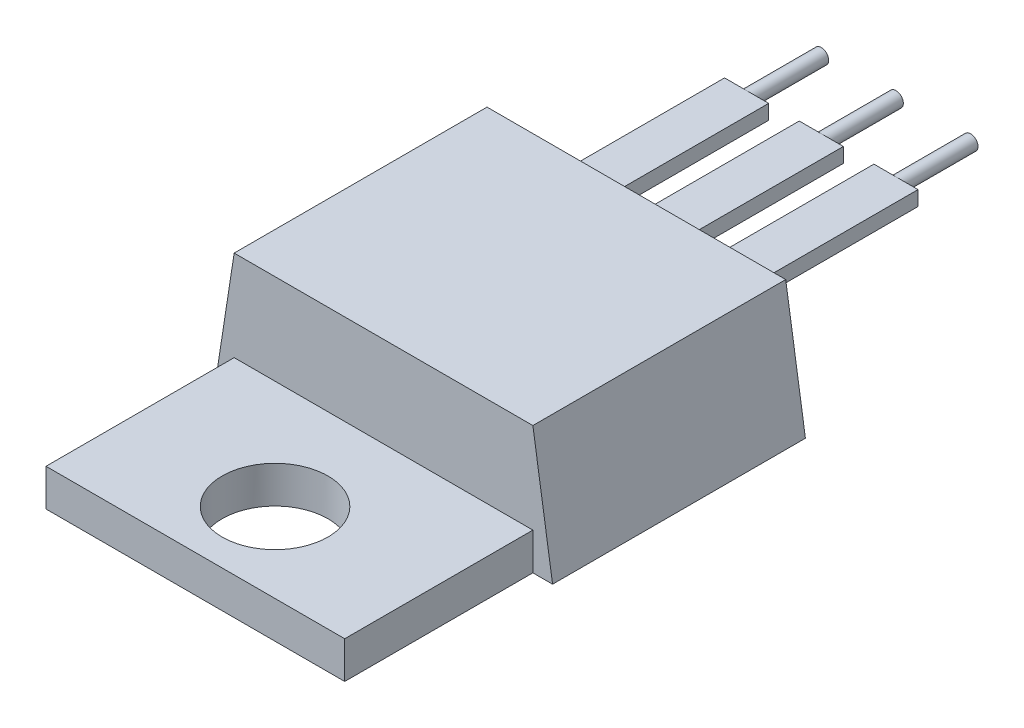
SolidWorks part; units mm, degrees
ref_plane "Спереди" through (0, 0, 0) normal (0, 0, 1) x (1, 0, 0)
ref_plane "Сверху" through (0, 0, 0) normal (0, 1, 0) x (1, 0, 0)
ref_plane "Справа" through (0, 0, 0) normal (1, 0, 0) x (0, 0, -1)
sketch "Эскиз1" plane through (0, 0, 0) normal (0, 0, 1) x (1, 0, 0)
  line L0 (-5.75, -2.7) -> (5.75, -2.7)
  line L1 (-5.08, 1.64) -> (5.08, 1.64)
  line L2 (5.75, -2.7) -> (5.08, 1.64)
  line L3 (-5.75, -2.7) -> (-5.08, 1.64)
extrude "Бобышка-Вытянуть1" add sketch "Эскиз1" along normal blind 8.6
sketch "Эскиз2" plane through (0, 0, 8.6) normal (0, 0, 1) x (1, 0, 0)
  line L0 (-5.75, -2.7) -> (5.75, -2.7) construction
  line L2 (-5.08, -2.7) -> (5.08, -2.7)
  line L3 (-5.08, -2.7) -> (-5.08, -1.44)
  line L4 (-5.08, -1.44) -> (5.08, -1.44)
  line L6 (5.08, -2.7) -> (5.08, -1.44)
extrude "Бобышка-Вытянуть2" add sketch "Эскиз2" along normal blind 6.4 and the other way blind 7.6 separate body
sketch "Эскиз3" plane through (0, -1.44, 0) normal (0, 1, 0) x (1, 0, 0)
  circle A0 centre (0, -12.29) radius 1.8
extrude "Вырез-Вытянуть1" cut sketch "Эскиз3" against normal up to surface (1.26 mm away)
sketch "Эскиз4" plane through (0, 0, 0) normal (0, 0, -1) x (-1, 0, 0)
  line L1 (-0.75, 0.25) -> (0.75, 0.25)
  line L2 (-0.75, 0.25) -> (-0.75, -0.25)
  line L3 (-0.75, -0.25) -> (0.75, -0.25)
  line L4 (0.75, 0.25) -> (0.75, -0.25)
  line L5 (-1.79, 0.25) -> (-3.29, 0.25)
  line L6 (-1.79, 0.25) -> (-1.79, -0.25)
  line L7 (-1.79, -0.25) -> (-3.29, -0.25)
  line L8 (-3.29, 0.25) -> (-3.29, -0.25)
  line L9 (1.79, 0.25) -> (3.29, 0.25)
  line L10 (1.79, 0.25) -> (1.79, -0.25)
  line L11 (1.79, -0.25) -> (3.29, -0.25)
  line L12 (3.29, 0.25) -> (3.29, -0.25)
extrude "Бобышка-Вытянуть3" add sketch "Эскиз4" along normal blind 6.29 separate body
sketch "Эскиз5" plane through (0, 0, -6.29) normal (0, 0, -1) x (-1, 0, 0)
  circle A0 centre (0, 0) radius 0.25
  circle A1 centre (-2.54, 0) radius 0.25
  circle A2 centre (2.54, 0) radius 0.25
extrude "Бобышка-Вытянуть4" add sketch "Эскиз5" along normal blind 2.54
